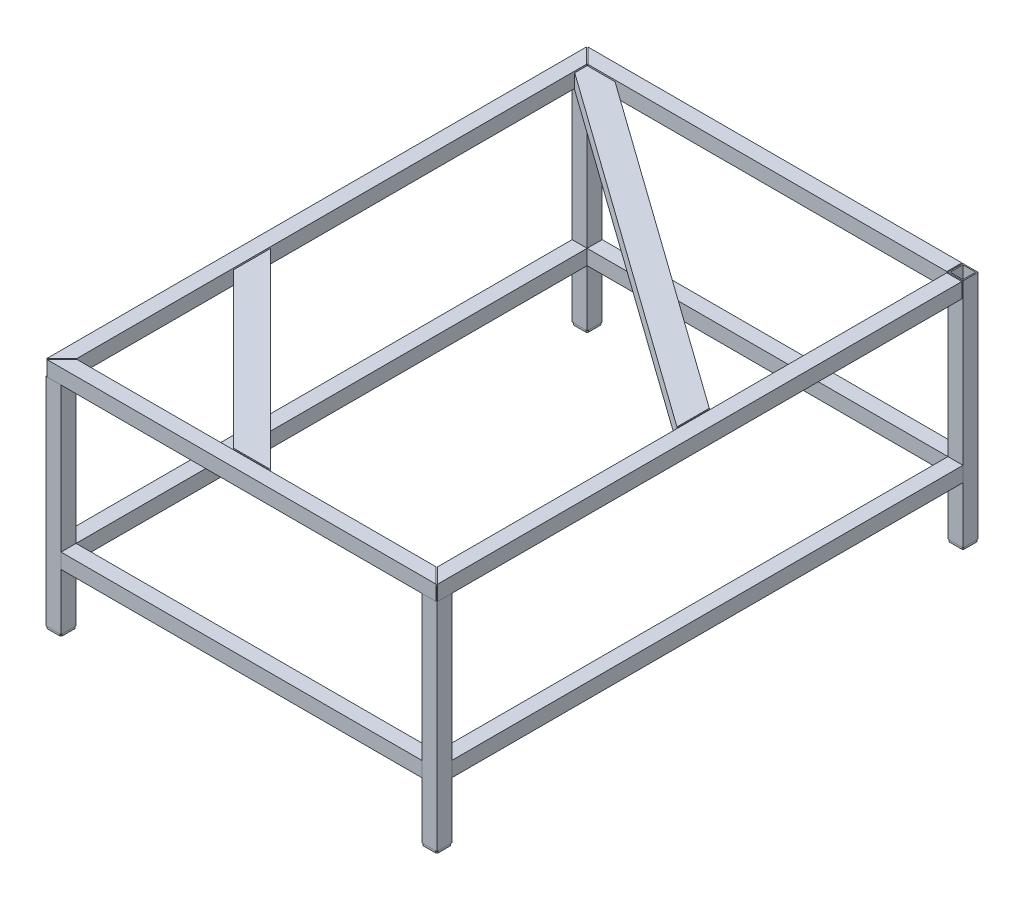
SolidWorks part; units mm, degrees
ref_plane "Front Plane" through (0, 0, 0) normal (0, 0, 1) x (1, 0, 0)
ref_plane "Top Plane" through (0, 0, 0) normal (0, 1, 0) x (1, 0, 0)
ref_plane "Right Plane" through (0, 0, 0) normal (1, 0, 0) x (0, 0, -1)
sketch3d "3DSketch1"
  line L0 (-1000, 600, -1400) -> (-1000, 600, 0)
  line L1 (-1000, 600, 0) -> (0, 600, 0)
  line L2 (0, 600, 0) -> (0, 600, -1400)
  line L3 (0, 600, -1400) -> (-1000, 600, -1400)
  line L4 (-1000, 600, 0) -> (-1000, 0, 0)
  line L5 (0, 600, 0) -> (0, 0, 0)
  line L6 (0, 600, -1400) -> (0, 0, -1400)
  line L7 (-1000, 600, -1400) -> (-1000, 0, -1400)
  line L8 (-1000, 175, 0) -> (-1000, 175, -1400)
  line L9 (-1000, 175, -1400) -> (0, 175, -1400)
  line L10 (0, 175, -1400) -> (0, 175, 0)
  line L11 (0, 175, 0) -> (-1000, 175, 0)
  line L12 (-1000, 600, -508) -> (-492, 600, 0)
  line L13 (-995.68, 600, -1400) -> (0, 600, -688.8)
  line L14 (-1000, 600, 0) -> (0, 600, -1400) construction
  line L15 (-492, 600, 0) -> (0, 600, -688.8) construction
  line L16 (-750, 175, -1400) -> (-750, 175, 0)
  line L17 (-250, 175, 0) -> (-250, 175, -1400)
  line L18 (-750, 175, -200) -> (-250, 175, -200)
  line L19 (-250, 175, -1200) -> (-750, 175, -1200)
  line L20 (0, 175, -200) -> (220, 175, -200)
  line L21 (220, 175, -200) -> (220, 335, -200)
  line L24 (-665, 175, 0) -> (-665, 175, 325)
  line L25 (-335, 175, 0) -> (-335, 175, 325)
  point P35 (0, 600, -700)
  dimension "D1" = 600
  dimension "D2" = 1400
  dimension "D7" = 250
  dimension "D3" = 1000
  dimension "D4" = 508
  dimension "D5" = 508
  dimension "D6" = 175
  dimension "D12" = 160
  dimension "D8" = 250
  dimension "D11" = 220
  dimension "D13" = 325
  dimension "B" = 200
  dimension "A" = 335
other "Structural Member1"
ref_plane "Plane1" through (-1000, 600, -1400) normal (0, 0, 1) x (1, 0, 0)
sketch "Sketch1" plane through (-1000, 600, -1400) normal (0, 0, 1) x (1, 0, 0)
  line L1 (-17, 17) -> (17, 17)
  line L2 (-17, 17) -> (-17, -17)
  line L3 (-17, -17) -> (17, -17)
  line L4 (17, 17) -> (17, -17)
  line L5 (-17, 17) -> (17, -17) construction
  line L6 (-17, -17) -> (17, 17) construction
  line L7 (-20, 20) -> (20, 20)
  line L8 (-20, 20) -> (-20, -20)
  line L9 (-20, -20) -> (20, -20)
  line L10 (20, 20) -> (20, -20)
  line L11 (-20, 20) -> (20, -20) construction
  line L12 (-20, -20) -> (20, 20) construction
  point P0 (0, 0)
  point P6 (0, 0)
  point P11 (0, 17)
  point P12 (0, 20)
  point P13 (-17, 0)
  point P14 (-20, 0)
  point P15 (17, 0)
  point P16 (20, 0)
  point P17 (0, -20)
  point P18 (0, -17)
  point P19 (0, 0)
  dimension "D1" = 3
  dimension "D4" = 40
  dimension "D2" = 3
  dimension "D3" = 40
other "Trim/Extend1"
other "Trim/Extend2"
other "Structural Member3"
ref_plane "Plane3" through (-995.68, 600, -1400) normal (0.8137, 0, 0.5812) x (0.5812, 0, -0.8137)
sketch "Sketch12" plane through (-995.68, 600, -1400) normal (0.8137, 0, 0.5812) x (0.5812, 0, -0.8137)
  line L1 (-17, 32) -> (17, 32)
  line L2 (-17, 32) -> (-17, -32)
  line L3 (-17, -32) -> (17, -32)
  line L4 (17, 32) -> (17, -32)
  line L5 (-17, 32) -> (17, -32) construction
  line L6 (-17, -32) -> (17, 32) construction
  line L7 (-20, 35) -> (20, 35)
  line L8 (-20, 35) -> (-20, -35)
  line L9 (-20, -35) -> (20, -35)
  line L10 (20, 35) -> (20, -35)
  line L11 (-20, 35) -> (20, -35) construction
  line L12 (-20, -35) -> (20, 35) construction
  point P0 (0, 0)
  point P6 (0, 0)
  point P11 (0, 32)
  point P12 (0, 35)
  point P13 (-17, 0)
  point P14 (-20, 0)
  point P15 (17, 0)
  point P16 (20, 0)
  point P17 (0, -35)
  point P18 (0, -32)
  point P19 (0, 0)
  dimension "D1" = 3
  dimension "D4" = 40
  dimension "D2" = 3
  dimension "D3" = 70
other "Trim/Extend3"
other "Trim/Extend4"
other "End cap1" parameters "D1"=5, "D2"=3, "D3"=3
